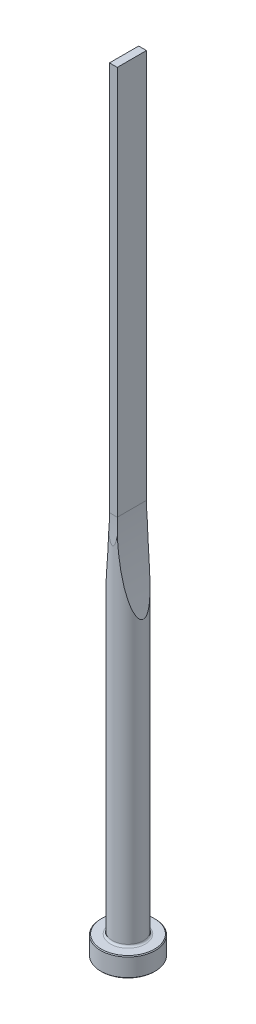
SolidWorks part; units mm, degrees
ref_plane "Front Plane" through (0, 0, 0) normal (0, 0, 1) x (1, 0, 0)
ref_plane "Top Plane" through (0, 0, 0) normal (0, 1, 0) x (1, 0, 0)
ref_plane "Right Plane" through (0, 0, 0) normal (1, 0, 0) x (0, 0, -1)
sketch "Sketch1" plane through (0, 0, 0) normal (0, 0, 1) x (1, 0, 0)
  line L0 (0, 0) -> (6.8, 0)
  line L1 (55, 0) -> (-55, 0) construction
  line L2 (7, 0.2) -> (7, 4.8)
  line L3 (6.8, 5) -> (4.5, 5)
  line L4 (4, 5.5) -> (4, 200)
  line L5 (0, 200) -> (4, 200)
  line L6 (7, 4.8) -> (6.8, 5)
  line L7 (6.8, 0) -> (7, 0.2)
  line L8 (0, 200) -> (0, 0)
  arc A0 (4, 5.5) -> (4.5, 5) centre (4.5, 5.5) ccw
  point P1 (7, 0)
  point P6 (7, 5)
  dimension "D4" = 0.5
  dimension "D1" = 4
  dimension "D2" = 7
  dimension "D3" = 5
  dimension "D5" = 200
revolve "Revolve1" add sketch "Sketch1" angle 360 about L8
sketch "Sketch2" plane through (0, 0, 0) normal (0, 0, 1) x (1, 0, 0)
  line L0 (1, 200) -> (1, 100)
  line L1 (4, 200) -> (-4, 200) construction
  line L2 (-1, 200) -> (-1, 100)
  line L3 (4, 200) -> (4, 76.9566)
  line L4 (-4, 200) -> (-4, 76.9566)
  line L5 (0, -7.7) -> (0, 7.7) construction
  line L6 (4, 200) -> (1, 200)
  line L8 (-1, 200) -> (-4, 200)
  arc A0 (1, 100) -> (4, 76.9566) centre (91, 100) ccw
  arc A1 (-1, 100) -> (-4, 76.9566) centre (-91, 100) cw
  dimension "D4" = 90
  dimension "D1" = 100
  dimension "D2" = 2
  dimension "D3" = 1
extrude "Cut-Extrude1" cut sketch "Sketch2" against normal mid plane 10
sketch "Sketch3" plane through (0, 0, 0) normal (1, 0, 0) x (0, 0, -1)
  line L0 (3.75, 200) -> (3.75, 100)
  line L1 (-3.873, 200) -> (3.873, 200) construction
  line L2 (-3.75, 200) -> (-3.75, 100)
  line L3 (4, 200) -> (4, 93.2965)
  line L4 (3.75, 200) -> (4, 200)
  line L5 (0, 7.7) -> (0, -7.7) construction
  line L6 (-4, 200) -> (-4, 93.2965)
  line L8 (-3.75, 200) -> (-4, 200)
  arc A0 (3.75, 100) -> (4, 93.2965) centre (93.75, 100) ccw
  arc A1 (-3.75, 100) -> (-4, 93.2965) centre (-93.75, 100) cw
  dimension "D2" = 90
  dimension "D1" = 100
  dimension "D3" = 7.5
  dimension "D4" = 3.75
extrude "Cut-Extrude2" cut sketch "Sketch3" against normal mid plane 10
